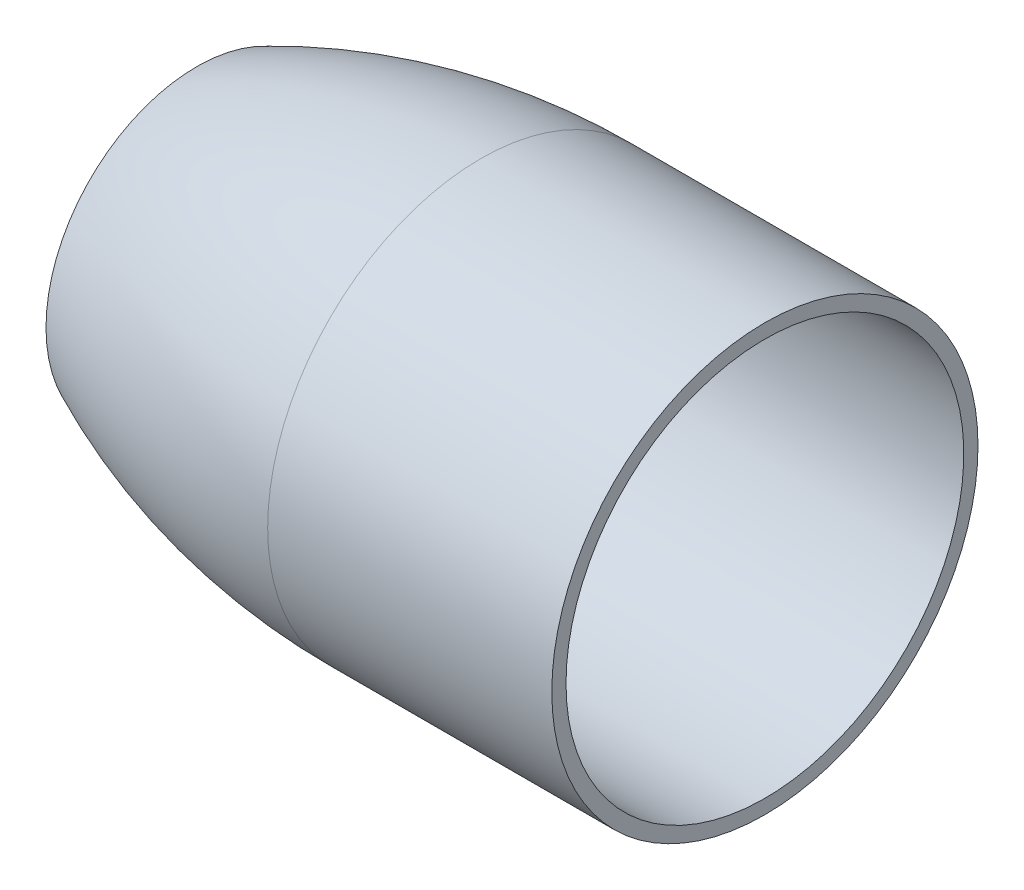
SolidWorks part; units mm, degrees
ref_plane "Спереди" through (0, 0, 0) normal (0, 0, 1) x (1, 0, 0)
ref_plane "Сверху" through (0, 0, 0) normal (0, 1, 0) x (1, 0, 0)
ref_plane "Справа" through (0, 0, 0) normal (1, 0, 0) x (0, 0, -1)
sketch "Эскиз1" plane through (0, 0, 0) normal (0, 0, 1) x (1, 0, 0)
  line L0 (-53.8909, 0) -> (90.8087, 0) construction
  line L1 (0, 14) -> (0, 15)
  line L2 (0, 14) -> (-20, 14)
  line L3 (0, 15) -> (-20, 15)
  line L4 (-40, 9.4995) -> (-40, 10.6036)
  arc A0 (-20, 14) -> (-40, 9.4995) centre (-20, -32.69) ccw
  arc A1 (-20, 15) -> (-40, 10.6036) centre (-20, -32.69) ccw
  point P8 (-124.3901, 30.582)
  dimension "D3" = 46.69
  dimension "D4" = 47.69
  dimension "D1" = 30
  dimension "D2" = 28
  dimension "D5" = 40
  dimension "D6" = 20
revolve "Повернуть1" add sketch "Эскиз1" angle 360 about L0
